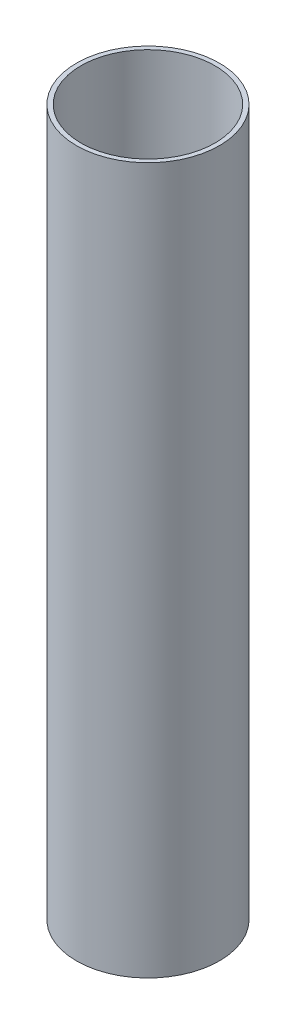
SolidWorks part; units mm, degrees
ref_plane "Front Plane" through (0, 0, 0) normal (0, 0, 1) x (1, 0, 0)
ref_plane "Top Plane" through (0, 0, 0) normal (0, 1, 0) x (1, 0, 0)
ref_plane "Right Plane" through (0, 0, 0) normal (1, 0, 0) x (0, 0, -1)
sketch "Sketch1" plane through (0, 0, 0) normal (0, 1, 0) x (1, 0, 0)
  circle A0 centre (0, 0) radius 50.8
  circle A1 centre (0, 0) radius 47.625
extrude "Extrude1" add sketch "Sketch1" against normal blind 501.65
